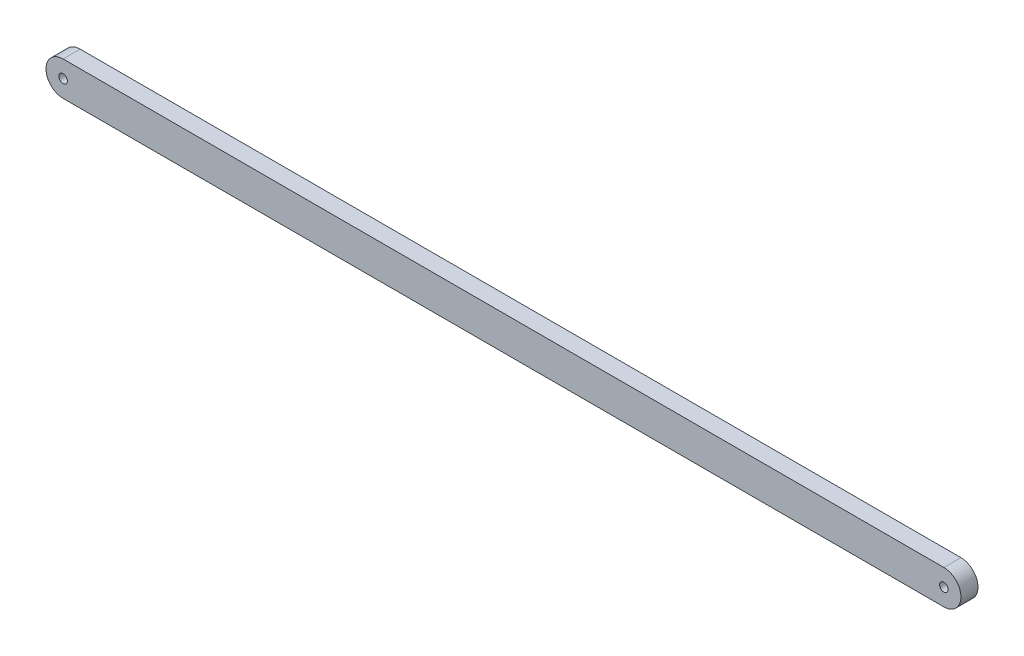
SolidWorks part; units mm, degrees
ref_plane "Front Plane" through (0, 0, 0) normal (0, 0, 1) x (1, 0, 0)
ref_plane "Top Plane" through (0, 0, 0) normal (0, 1, 0) x (1, 0, 0)
ref_plane "Right Plane" through (0, 0, 0) normal (1, 0, 0) x (0, 0, -1)
sketch "Sketch1" plane through (0, 0, 0) normal (0, 0, 1) x (1, 0, 0)
  line L0 (0, 0) -> (131.064, 0) construction
  line L1 (0, 2.54) -> (131.064, 2.54)
  line L2 (0, -2.54) -> (131.064, -2.54)
  arc A0 (0, 2.54) -> (0, -2.54) centre (0, 0) ccw
  arc A1 (131.064, -2.54) -> (131.064, 2.54) centre (131.064, 0) ccw
  point P3 (65.532, 0)
  dimension "D1" = 2.54
  dimension "D2" = 131.064
extrude "Boss-Extrude1" add sketch "Sketch1" along normal blind 2.54
sketch "Sketch2" plane through (0, 0, 2.54) normal (0, 0, 1) x (1, 0, 0)
  circle A0 centre (0, 0) radius 0.635
  dimension "D1" = 1.27
extrude "Cut-Extrude1" cut sketch "Sketch2" against normal through all both and the other way through all
ref_plane "Plane1" through (65.532, 0, 0) normal (1, 0, 0) x (0, 0, -1)
mirror "Mirror1" about plane through (65.532, 0, 0) normal (1, 0, 0) of "Cut-Extrude1"
